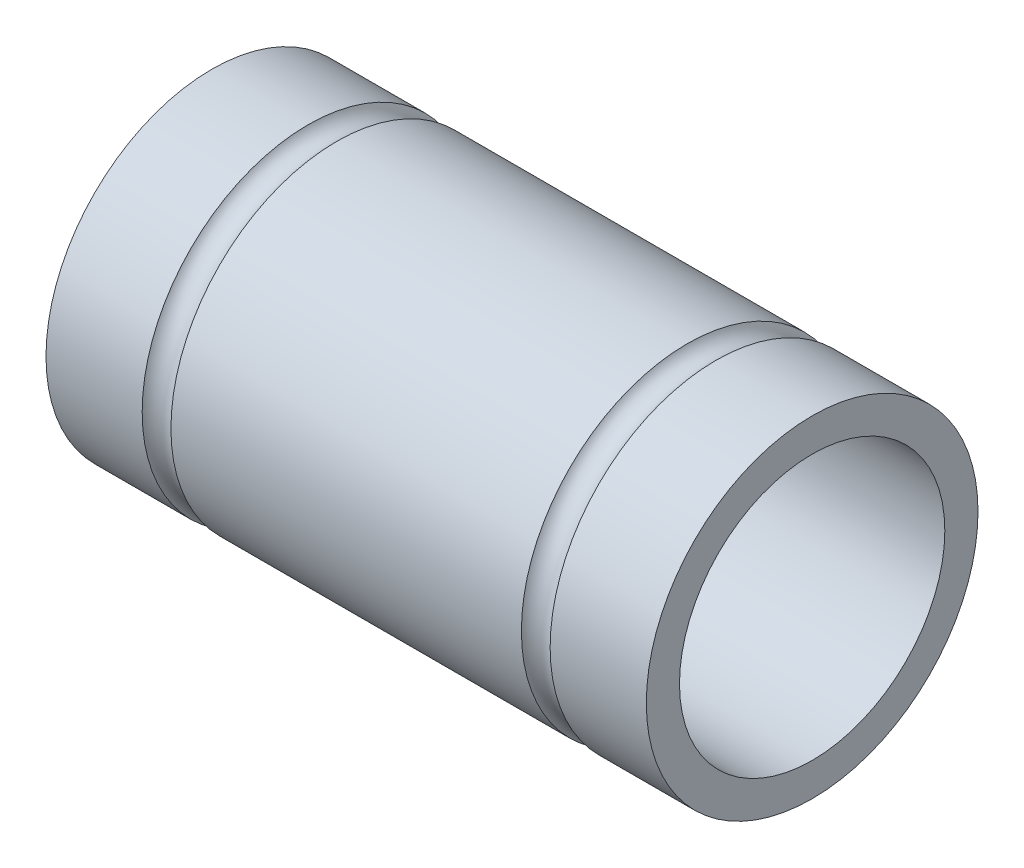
SolidWorks part; units mm, degrees
ref_plane "Plan1" through (0, 0, 0) normal (0, 0, 1) x (1, 0, 0)
ref_plane "Plan2" through (0, 0, 0) normal (0, 1, 0) x (1, 0, 0)
ref_plane "Plan3" through (0, 0, 0) normal (1, 0, 0) x (0, 0, -1)
sketch "Esquisse1" plane through (0, 0, 0) normal (0, 0, 1) x (1, 0, 0)
  line L0 (-100, 0) -> (110, 0) construction
  line L1 (-70, 12) -> (-15.7, 12)
  line L2 (-70, 15) -> (-61.3, 15)
  line L3 (-70, 15) -> (-70, 12)
  line L5 (-15.7, 15) -> (-15.7, 12)
  line L11 (-58.7, 15) -> (-27, 15)
  line L12 (-24.4, 15) -> (-15.7, 15)
  arc A4 (-61.3, 15) -> (-58.7, 15) centre (-60, 15.7483) ccw
  arc A10 (-27, 15) -> (-24.4, 15) centre (-25.7, 15.7483) ccw
  dimension "D1" = 12
  dimension "D2" = 15
  dimension "D4" = 54.3
revolve "Base-Révolution" add sketch "Esquisse1" angle 360 about L0
